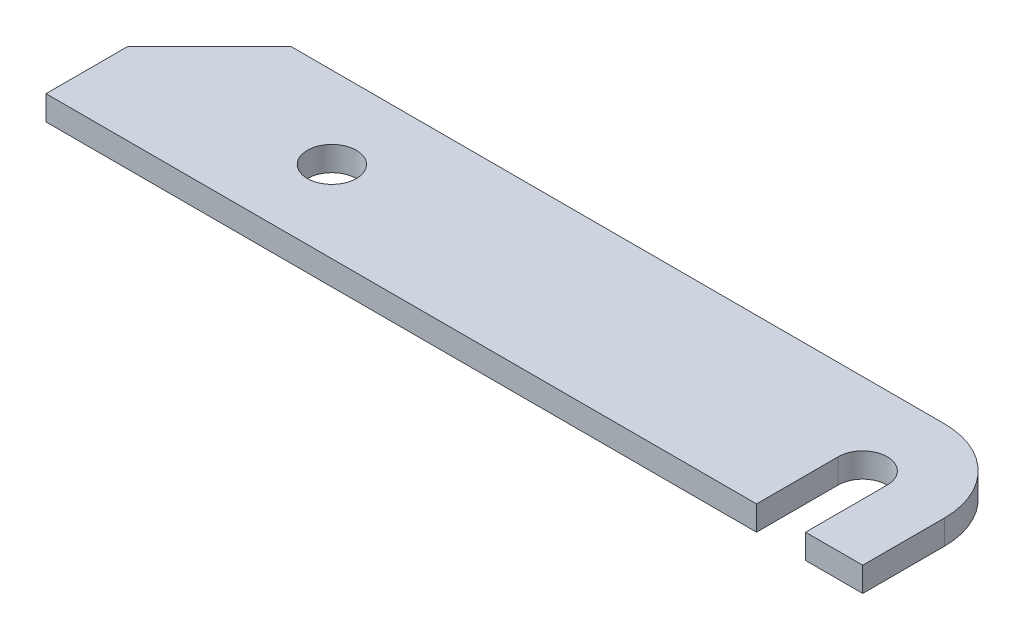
SolidWorks part; units mm, degrees
ref_plane "Front" through (0, 0, 0) normal (0, 0, 1) x (1, 0, 0)
ref_plane "Top" through (0, 0, 0) normal (0, 1, 0) x (1, 0, 0)
ref_plane "Right" through (0, 0, 0) normal (1, 0, 0) x (0, 0, -1)
sketch "Sketch1" plane through (0, 0, 0) normal (0, 1, 0) x (1, 0, 0)
  line L0 (93, 0) -> (100, 0)
  line L1 (0, 0) -> (87, 0)
  line L2 (0, 0) -> (0, 10)
  line L3 (10, 20) -> (90, 20)
  line L4 (100, 0) -> (100, 10)
  line L6 (0, 10) -> (10, 20)
  line L9 (87, 10) -> (87, 0)
  line L10 (93, 10) -> (93, 0)
  circle A0 centre (25, 10) radius 3
  arc A1 (100, 10) -> (90, 20) centre (90, 10) ccw
  arc A2 (93, 10) -> (87, 10) centre (90, 10) ccw
extrude "Extrude1" add sketch "Sketch1" along normal blind 3
